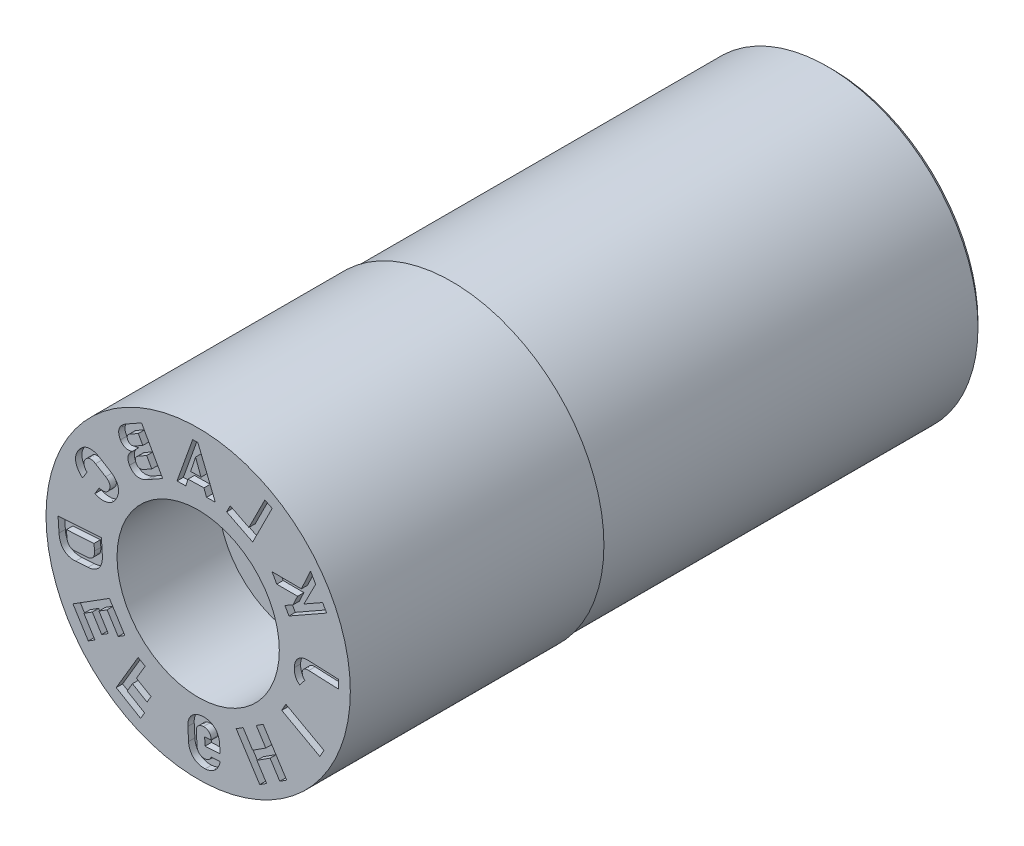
SolidWorks part; units mm, degrees
ref_plane "Front Plane" through (0, 0, 0) normal (0, 0, 1) x (1, 0, 0)
ref_plane "Top Plane" through (0, 0, 0) normal (0, 1, 0) x (1, 0, 0)
ref_plane "Right Plane" through (0, 0, 0) normal (1, 0, 0) x (0, 0, -1)
sketch "Sketch1" plane through (0, 0, 0) normal (1, 0, 0) x (0, 0, -1)
  line L2 (0, 6) -> (0, 3.2)
  line L3 (24.75, 6) -> (0, 6)
  line L4 (-3.7979, 0) -> (49996.2021, 0) construction
  line L8 (19, 1.5) -> (4, 1.5)
  line L9 (4, 3.2) -> (4, 1.5)
  line L10 (4, 3.2) -> (0, 3.2)
  line L12 (25, 3) -> (25, 5.75)
  line L16 (25, 5.75) -> (24.75, 6)
  line L17 (25, 3) -> (19, 3)
  line L18 (19, 1.5) -> (19, 3)
  dimension "D1" = 25
  dimension "D2" = 45
  dimension "D3" = 0.25
  dimension "D4" = 12
  dimension "D5" = 6.4
  dimension "D6" = 4
  dimension "D7" = 3
  dimension "D8" = 6
  dimension "D9" = 6
revolve "Revolve1" add sketch "Sketch1" angle 360 about L4
sketch "Sketch4" plane through (0, 0, 0) normal (1, 0, 0) x (0, 0, -1)
  line L0 (0, 0) -> (50000, 0) construction
  line L1 (25, -5.75) -> (25, 5.75) construction
  line L2 (10, 6.935) -> (25, 6.935)
  line L3 (10, 6.935) -> (10, 5.935)
  line L4 (10, 5.935) -> (25, 5.935)
  line L5 (25, 6.935) -> (25, 5.935)
  line L6 (24.75, 6) -> (0, 6) construction
  line L9 (0, 6.6) -> (0, -6.6) construction
  dimension "D1" = 1
  dimension "D2" = 0.065
  dimension "D3" = 10
revolve "Cut-Revolve1" cut sketch "Sketch4" angle 360 about L0
sketch "Sketch2" plane through (0, 0, 0) normal (0, 0, 1) x (1, 0, 0)
  line L0 (0, 0) -> (0, 6) construction
  line L1 (0, 0) -> (3, 5.1962) construction
  line L2 (0, 0) -> (5.1962, 3) construction
  line L3 (0, 0) -> (6, 0) construction
  line L4 (0, 0) -> (5.1962, -3) construction
  line L5 (0, 0) -> (3, -5.1962) construction
  line L6 (0, 0) -> (0, -6) construction
  line L7 (0, 0) -> (-3, -5.1962) construction
  line L8 (0, 0) -> (-5.1962, -3) construction
  line L9 (0, 0) -> (-6, 0) construction
  line L10 (0, 0) -> (-5.1962, 3) construction
  line L11 (0, 0) -> (-3, 5.1962) construction
  line L12 (4.1712, 2.0725) -> (4.6327, 2.9745)
  line L13 (4.6327, 2.9745) -> (4.4324, 3.3271)
  line L14 (4.4324, 3.3271) -> (4.069, 2.5376)
  line L16 (5.0662, 2.2101) -> (4.9073, 2.49)
  line L17 (4.9073, 2.49) -> (4.1712, 2.0725)
  line L18 (3.4215, 1.6471) -> (3.5804, 1.3672)
  line L19 (3.5804, 1.3672) -> (5.0662, 2.2101)
  line L20 (3.9184, 2.2106) -> (3.743, 1.8295)
  line L21 (4.069, 2.5376) -> (2.9114, 2.5466)
  line L22 (2.9114, 2.5466) -> (3.0998, 2.2142)
  line L23 (3.0998, 2.2142) -> (3.9184, 2.2106)
  line L24 (2.919, 4.7111) -> (2.6298, 4.8562)
  line L25 (2.6298, 4.8562) -> (2.0003, 3.6009)
  line L26 (-2.3603, 4.6286) -> (-2.1818, 4.3099)
  line L27 (2.1498, 3.1773) -> (2.919, 4.7111)
  line L28 (2.0003, 3.6009) -> (1.2621, 3.9712)
  line L29 (1.2621, 3.9712) -> (1.1225, 3.6927)
  line L30 (1.1225, 3.6927) -> (2.1498, 3.1773)
  line L31 (-2.0309, 4.0405) -> (-1.8308, 3.6834)
  line L32 (-0.0126, 5.4955) -> (-0.217, 5.4912)
  line L33 (-0.217, 5.4912) -> (-0.8349, 3.7694)
  line L34 (-0.8349, 3.7694) -> (-0.4881, 3.7766)
  line L35 (-0.4881, 3.7766) -> (-0.398, 4.0524)
  line L36 (-0.1038, 4.9519) -> (0.1127, 4.3734)
  line L37 (0.3296, 3.7936) -> (0.676, 3.8009)
  line L38 (0.676, 3.8009) -> (-0.0126, 5.4955)
  line L39 (0.1127, 4.3734) -> (-0.2958, 4.3649)
  line L41 (-0.398, 4.0524) -> (0.2279, 4.0655)
  line L42 (0.2279, 4.0655) -> (0.3296, 3.7936)
  line L43 (-1.8308, 3.6834) -> (-2.147, 3.5063)
  line L44 (-2.4469, 3.5702) -> (-2.4488, 3.5733)
  line L45 (-2.3471, 3.8634) -> (-2.0309, 4.0405)
  line L46 (-3.9121, -2.2103) -> (-3.5892, -2.0073)
  line L47 (-2.1818, 4.3099) -> (-2.4982, 4.1328)
  line L48 (-2.6764, 4.4515) -> (-2.3603, 4.6286)
  line L49 (-2.4335, -3.7648) -> (-2.0896, -3.1835)
  line L50 (-2.2315, 5.0549) -> (-2.8368, 4.7157)
  line L51 (-2.7072, 3.3737) -> (-2.7056, 3.3708)
  line L52 (-2.0229, 3.2219) -> (-1.8999, 3.2907)
  line L54 (2.8353, -3.8614) -> (3.219, -4.4581)
  line L56 (-1.8999, 3.2907) -> (-1.4002, 3.5707)
  line L57 (-1.4002, 3.5707) -> (-2.2315, 5.0549)
  line L58 (-3.4712, 2.793) -> (-3.8723, 3.0385)
  line L59 (-4.5581, 2.0107) -> (-4.3832, 2.2967)
  line L60 (-4.0471, 2.753) -> (-3.646, 2.5075)
  line L61 (-3.9005, 2.0011) -> (-4.0754, 1.7151)
  line L62 (-4.105, 0.0024) -> (-4.0884, -0.248)
  line L63 (-4.3591, -0.5997) -> (-4.8622, -0.6329)
  line L64 (-5.1764, -0.3196) -> (-5.1929, -0.0694)
  line L65 (2.1486, -3.9326) -> (1.7728, -3.3479)
  line L66 (3.743, 1.8295) -> (3.4215, 1.6471)
  line L67 (-4.8306, -0.9659) -> (-4.3463, -0.9338)
  line L68 (-3.779, -0.2192) -> (-3.8161, 0.3448)
  line L70 (-5.5244, 0.2322) -> (-5.4872, -0.3329)
  line L71 (-5.1929, -0.0694) -> (-4.105, 0.0024)
  line L73 (-3.8161, 0.3448) -> (-5.5244, 0.2322)
  line L75 (-4.5063, -2.5838) -> (-4.1735, -2.3746)
  line L77 (-3.4981, -1.5714) -> (-4.9382, -2.4766)
  line L78 (-3.5892, -2.0073) -> (-3.1535, -2.7008)
  line L79 (-3.1535, -2.7008) -> (-2.8918, -2.5365)
  line L80 (-2.8918, -2.5365) -> (-3.4981, -1.5714)
  line L82 (-4.1735, -2.3746) -> (-3.8061, -2.9589)
  line L83 (-3.8061, -2.9589) -> (-3.5448, -2.7944)
  line L84 (-3.5448, -2.7944) -> (-3.9121, -2.2103)
  line L86 (-4.9382, -2.4766) -> (-4.3319, -3.4417)
  line L87 (-4.3319, -3.4417) -> (-4.0706, -3.2772)
  line L88 (-4.0706, -3.2772) -> (-4.5063, -2.5838)
  line L91 (-2.7986, -4.382) -> (-2.5907, -4.0305)
  line L92 (-2.0896, -3.1835) -> (-2.3656, -3.0202)
  line L93 (-2.3656, -3.0202) -> (-3.2317, -4.4844)
  line L94 (-2.5907, -4.0305) -> (-2.016, -4.3705)
  line L95 (-2.016, -4.3705) -> (-1.8587, -4.1049)
  line L96 (-1.8587, -4.1049) -> (-2.4335, -3.7648)
  line L98 (-3.2317, -4.4844) -> (-2.27, -5.0535)
  line L99 (-2.27, -5.0535) -> (-2.1127, -4.7878)
  line L100 (-2.1127, -4.7878) -> (-2.7986, -4.382)
  line L102 (0.8636, -4.6997) -> (0.8458, -4.366)
  line L103 (-0.4057, -4.3953) -> (-0.3789, -4.8992)
  line L104 (0.8635, -4.9638) -> (0.5159, -4.9823)
  line L105 (-0.0456, -4.8814) -> (-0.0723, -4.3775)
  line L106 (0.5116, -4.3793) -> (0.5133, -4.4075)
  line L107 (0.5133, -4.4075) -> (0.2552, -4.4215)
  line L108 (0.2552, -4.4215) -> (0.2718, -4.7315)
  line L109 (0.2718, -4.7315) -> (0.8636, -4.6997)
  line L110 (3.219, -4.4581) -> (3.4908, -4.2835)
  line L111 (3.4908, -4.2835) -> (2.5629, -2.8401)
  line L112 (2.5629, -2.8401) -> (2.2911, -3.0147)
  line L113 (2.2911, -3.0147) -> (2.6669, -3.5993)
  line L114 (2.4284, -4.9662) -> (2.7007, -4.7913)
  line L115 (2.7007, -4.7913) -> (2.3171, -4.1947)
  line L116 (1.7728, -3.3479) -> (1.5005, -3.5228)
  line L117 (1.5005, -3.5228) -> (2.4284, -4.9662)
  line L118 (2.3171, -4.1947) -> (2.8353, -3.8614)
  line L120 (2.6669, -3.5993) -> (2.1486, -3.9326)
  line L122 (3.4567, -1.7056) -> (3.2958, -1.9988)
  line L123 (3.2958, -1.9988) -> (4.798, -2.8227)
  line L124 (4.798, -2.8227) -> (4.9589, -2.5294)
  line L125 (4.9589, -2.5294) -> (3.4567, -1.7056)
  line L126 (4.0038, -0.7722) -> (4.2063, -0.5172)
  line L127 (4.3611, -0.1037) -> (5.5253, -0.1536)
  line L128 (5.5253, -0.1536) -> (5.5396, 0.1799)
  line L129 (5.5396, 0.1799) -> (4.374, 0.23)
  line L130 (-0.2958, 4.3649) -> (-0.1038, 4.9519)
  circle A0 centre (0, 0) radius 3.8653 construction
  circle A1 centre (0, 0) radius 6 construction
  spline S0 degree 3 poles (-2.147, 3.5063) (-2.1759, 3.491) (-2.2197, 3.4709) (-2.2805, 3.4642) (-2.3215, 3.4679) (-2.3595, 3.4809) (-2.4068, 3.5105) (-2.4327, 3.5454) (-2.4469, 3.5702) knots 0 0 0 0 0.283986 0.407341 0.523418 0.636508 0.75074 1 1 1 1
  spline S1 degree 3 poles (-2.4488, 3.5733) (-2.4587, 3.5907) (-2.4706, 3.6178) (-2.4784, 3.6553) (-2.4796, 3.6822) (-2.4771, 3.7085) (-2.4701, 3.7339) (-2.4594, 3.7587) (-2.4442, 3.7823) (-2.4253, 3.8047) (-2.3947, 3.8344) (-2.3666, 3.852) (-2.3471, 3.8634) knots 0 0 0 0 0.172486 0.251676 0.328325 0.402454 0.477689 0.553909 0.633799 0.717923 0.805334 1 1 1 1
  spline S2 degree 3 poles (-2.4982, 4.1328) (-2.5243, 4.1192) (-2.564, 4.1006) (-2.6194, 4.0961) (-2.6571, 4.1004) (-2.692, 4.1135) (-2.7363, 4.1416) (-2.7599, 4.1753) (-2.7738, 4.1986) knots 0 0 0 0 0.277832 0.398607 0.514672 0.628815 0.743813 1 1 1 1
  spline S3 degree 3 poles (-2.7738, 4.1986) (-2.7858, 4.2202) (-2.7992, 4.2551) (-2.7984, 4.3034) (-2.7895, 4.3375) (-2.7725, 4.37) (-2.7376, 4.4123) (-2.7025, 4.4373) (-2.6764, 4.4515) knots 0 0 0 0 0.243006 0.354161 0.466966 0.585008 0.709189 1 1 1 1
  spline S4 degree 3 poles (-2.8368, 4.7157) (-2.8815, 4.6908) (-2.9439, 4.6494) (-3.014, 4.583) (-3.0564, 4.5322) (-3.0902, 4.4788) (-3.1148, 4.423) (-3.1295, 4.365) (-3.1356, 4.3056) (-3.1319, 4.2446) (-3.1148, 4.1598) (-3.0876, 4.0988) (-3.0656, 4.0594) knots 0 0 0 0 0.194786 0.282854 0.366198 0.445692 0.522431 0.59692 0.672178 0.748789 0.828229 1 1 1 1
  spline S5 degree 3 poles (-3.0656, 4.0594) (-3.0499, 4.0322) (-3.024, 3.9933) (-2.9806, 3.9507) (-2.9461, 3.9242) (-2.909, 3.9028) (-2.8696, 3.8863) (-2.8277, 3.8758) (-2.7839, 3.8698) (-2.7384, 3.8695) (-2.6743, 3.876) (-2.6265, 3.8894) (-2.5949, 3.9007) knots 0 0 0 0 0.172797 0.253868 0.332914 0.410582 0.4882 0.566647 0.646914 0.729831 0.815675 1 1 1 1
  spline S6 degree 3 poles (-2.5949, 3.9007) (-2.6232, 3.8789) (-2.6631, 3.8442) (-2.7049, 3.7896) (-2.7299, 3.7478) (-2.7493, 3.7043) (-2.7616, 3.6591) (-2.7688, 3.6131) (-2.7685, 3.5659) (-2.7628, 3.518) (-2.7461, 3.452) (-2.7246, 3.4045) (-2.7072, 3.3737) knots 0 0 0 0 0.180058 0.263783 0.344958 0.424782 0.502383 0.580016 0.658446 0.73902 0.822029 1 1 1 1
  spline S7 degree 3 poles (-2.7056, 3.3708) (-2.6835, 3.3308) (-2.645, 3.2756) (-2.5812, 3.2157) (-2.5305, 3.181) (-2.4764, 3.1544) (-2.4187, 3.1374) (-2.3581, 3.1289) (-2.2946, 3.1298) (-2.2288, 3.1394) (-2.1356, 3.1653) (-2.0675, 3.1966) (-2.0229, 3.2219) knots 0 0 0 0 0.172849 0.252224 0.329274 0.404442 0.479146 0.555557 0.635162 0.718344 0.806128 1 1 1 1
  spline S8 degree 3 poles (-3.2499, 1.9297) (-3.2335, 1.9567) (-3.2107, 1.9974) (-3.1863, 2.0534) (-3.1708, 2.0942) (-3.1584, 2.1348) (-3.1485, 2.1751) (-3.142, 2.2151) (-3.1382, 2.2548) (-3.1377, 2.294) (-3.1394, 2.3325) (-3.1447, 2.3704) (-3.1529, 2.4077) (-3.1637, 2.4444) (-3.1775, 2.4804) (-3.194, 2.5159) (-3.2139, 2.5504) (-3.2362, 2.5843) (-3.2617, 2.617) (-3.2898, 2.6489) (-3.3205, 2.6798) (-3.354, 2.7098) (-3.4035, 2.7489) (-3.4431, 2.7763) (-3.4712, 2.793) knots 0 0 0 0 0.093395 0.137867 0.180685 0.222706 0.263356 0.30334 0.342595 0.381331 0.419141 0.456735 0.494484 0.53194 0.569988 0.608498 0.647681 0.687739 0.728571 0.77031 0.813445 0.857468 0.903297 1 1 1 1
  spline S9 degree 3 poles (-3.8723, 3.0385) (-3.9001, 3.0556) (-3.9421, 3.079) (-3.9995, 3.1051) (-4.0414, 3.1214) (-4.0831, 3.1345) (-4.1241, 3.1457) (-4.1649, 3.1528) (-4.2051, 3.1575) (-4.2449, 3.1591) (-4.2841, 3.1579) (-4.3225, 3.154) (-4.3601, 3.1468) (-4.397, 3.1371) (-4.4331, 3.1244) (-4.4687, 3.1091) (-4.5032, 3.0905) (-4.537, 3.0693) (-4.5698, 3.0455) (-4.6015, 3.0186) (-4.6319, 2.9888) (-4.6613, 2.9565) (-4.6997, 2.909) (-4.7258, 2.8705) (-4.7423, 2.8435) knots 0 0 0 0 0.096419 0.14217 0.186461 0.229443 0.271255 0.312127 0.351941 0.391171 0.429722 0.467793 0.505489 0.542813 0.580646 0.618521 0.657329 0.6966 0.736521 0.777346 0.819285 0.862414 0.90656 1 1 1 1
  spline S10 degree 3 poles (-4.7423, 2.8435) (-4.7687, 2.7996) (-4.8024, 2.7309) (-4.8267, 2.6337) (-4.8351, 2.5615) (-4.834, 2.4889) (-4.8231, 2.4166) (-4.8021, 2.3452) (-4.7717, 2.2746) (-4.7321, 2.2051) (-4.665, 2.1126) (-4.6031, 2.0501) (-4.5581, 2.0107) knots 0 0 0 0 0.164359 0.242523 0.319819 0.396758 0.474197 0.553045 0.634665 0.719808 0.808406 1 1 1 1
  spline S11 degree 3 poles (-4.3832, 2.2967) (-4.4025, 2.316) (-4.4305, 2.3454) (-4.4596, 2.3891) (-4.4772, 2.4214) (-4.4901, 2.4541) (-4.5001, 2.4865) (-4.5046, 2.5192) (-4.5058, 2.5515) (-4.503, 2.5836) (-4.4921, 2.6259) (-4.4786, 2.6561) (-4.4667, 2.675) knots 0 0 0 0 0.195176 0.28654 0.37324 0.456219 0.536212 0.614028 0.690102 0.765908 0.841951 1 1 1 1
  spline S12 degree 3 poles (-4.4667, 2.675) (-4.4522, 2.6992) (-4.427, 2.7322) (-4.3866, 2.7677) (-4.3552, 2.7883) (-4.3215, 2.8031) (-4.2861, 2.8124) (-4.249, 2.8162) (-4.2103, 2.8148) (-4.1706, 2.8071) (-4.1141, 2.7905) (-4.0739, 2.7687) (-4.0471, 2.753) knots 0 0 0 0 0.174816 0.254583 0.331752 0.4066 0.480982 0.557388 0.636835 0.719716 0.807055 1 1 1 1
  spline S13 degree 3 poles (-3.646, 2.5075) (-3.6195, 2.4913) (-3.5827, 2.4645) (-3.5416, 2.4226) (-3.5171, 2.3906) (-3.4982, 2.357) (-3.4851, 2.3222) (-3.4775, 2.2864) (-3.4754, 2.2497) (-3.4792, 2.2122) (-3.4925, 2.16) (-3.511, 2.1227) (-3.5256, 2.0986) knots 0 0 0 0 0.192502 0.280292 0.362664 0.441768 0.517825 0.592476 0.667438 0.744799 0.824735 1 1 1 1
  spline S14 degree 3 poles (-3.5256, 2.0986) (-3.5375, 2.0795) (-3.5578, 2.0526) (-3.5913, 2.0238) (-3.6183, 2.0061) (-3.6477, 1.9921) (-3.6787, 1.981) (-3.712, 1.9752) (-3.7469, 1.9723) (-3.7834, 1.9732) (-3.8356, 1.9804) (-3.8744, 1.9918) (-3.9005, 2.0011) knots 0 0 0 0 0.160081 0.236116 0.312169 0.388724 0.466101 0.54522 0.627432 0.713977 0.803689 1 1 1 1
  spline S15 degree 3 poles (-4.0754, 1.7151) (-4.0195, 1.6936) (-3.9356, 1.667) (-3.8226, 1.6494) (-3.7428, 1.6459) (-3.6661, 1.6505) (-3.5931, 1.6645) (-3.524, 1.6875) (-3.4591, 1.7192) (-3.3982, 1.7591) (-3.3233, 1.8255) (-3.2765, 1.8859) (-3.2499, 1.9297) knots 0 0 0 0 0.192102 0.280672 0.365808 0.447541 0.526353 0.603189 0.680187 0.757178 0.835634 1 1 1 1
  spline S16 degree 3 poles (-4.0884, -0.248) (-4.0871, -0.273) (-4.0862, -0.3097) (-4.0917, -0.357) (-4.0978, -0.3894) (-4.1063, -0.4199) (-4.1177, -0.4483) (-4.1319, -0.4745) (-4.1484, -0.4987) (-4.1673, -0.5204) (-4.188, -0.54) (-4.2113, -0.5564) (-4.2367, -0.5704) (-4.2643, -0.5818) (-4.3049, -0.5937) (-4.3371, -0.5986) (-4.3591, -0.5997) knots 0 0 0 0 0.14907 0.217385 0.282879 0.345337 0.405621 0.464448 0.522126 0.579343 0.63528 0.691485 0.748535 0.807147 0.868664 1 1 1 1
  spline S17 degree 3 poles (-4.8622, -0.6329) (-4.8842, -0.6344) (-4.9168, -0.6345) (-4.9585, -0.6272) (-4.9876, -0.6202) (-5.0143, -0.609) (-5.0396, -0.5959) (-5.063, -0.5795) (-5.0844, -0.5602) (-5.104, -0.5385) (-5.1208, -0.514) (-5.1361, -0.4876) (-5.1486, -0.4585) (-5.1592, -0.4273) (-5.1698, -0.3809) (-5.1751, -0.3447) (-5.1764, -0.3196) knots 0 0 0 0 0.131403 0.192788 0.251651 0.30887 0.364824 0.421034 0.478337 0.535992 0.59437 0.654772 0.717284 0.782701 0.85073 1 1 1 1
  spline S18 degree 3 poles (-5.4872, -0.3329) (-5.485, -0.3673) (-5.4796, -0.4179) (-5.4677, -0.4835) (-5.4565, -0.5296) (-5.4438, -0.5737) (-5.4287, -0.6156) (-5.4116, -0.6555) (-5.392, -0.693) (-5.371, -0.7286) (-5.3473, -0.7614) (-5.3225, -0.7923) (-5.2948, -0.8203) (-5.2659, -0.8464) (-5.2349, -0.8697) (-5.2021, -0.8908) (-5.1672, -0.9093) (-5.1307, -0.9255) (-5.0926, -0.9392) (-5.0527, -0.9498) (-5.0114, -0.9586) (-4.9684, -0.9644) (-4.9079, -0.9687) (-4.8617, -0.9676) (-4.8306, -0.9659) knots 0 0 0 0 0.09974 0.147124 0.192678 0.236825 0.279748 0.32161 0.362273 0.402114 0.440851 0.479134 0.516793 0.5544 0.591662 0.629051 0.667054 0.705622 0.744502 0.784211 0.824761 0.866534 0.909716 1 1 1 1
  spline S19 degree 3 poles (-4.3463, -0.9338) (-4.3166, -0.9317) (-4.2726, -0.9267) (-4.2158, -0.9146) (-4.1751, -0.9044) (-4.1366, -0.8904) (-4.0992, -0.8751) (-4.0636, -0.8573) (-4.0296, -0.8373) (-3.9973, -0.8152) (-3.9672, -0.7904) (-3.9393, -0.7634) (-3.9127, -0.7347) (-3.8896, -0.7027) (-3.8674, -0.6694) (-3.848, -0.6334) (-3.8301, -0.5954) (-3.8149, -0.555) (-3.8018, -0.5129) (-3.7915, -0.4688) (-3.784, -0.4227) (-3.7789, -0.3745) (-3.775, -0.3064) (-3.7765, -0.2543) (-3.779, -0.2192) knots 0 0 0 0 0.08643 0.127888 0.168208 0.207699 0.246676 0.285052 0.323013 0.360748 0.398341 0.435858 0.473305 0.51134 0.549953 0.589151 0.629809 0.671474 0.71404 0.757555 0.802537 0.849254 0.897844 1 1 1 1
  spline S20 degree 3 poles (0.8458, -4.366) (0.8437, -4.3352) (0.8397, -4.2896) (0.8281, -4.2305) (0.8174, -4.1884) (0.8044, -4.1477) (0.789, -4.1085) (0.7713, -4.071) (0.7513, -4.0351) (0.7293, -4.0009) (0.7049, -3.969) (0.6794, -3.9387) (0.6514, -3.9111) (0.6216, -3.8855) (0.5898, -3.8625) (0.5565, -3.8409) (0.5211, -3.8222) (0.4842, -3.8055) (0.4459, -3.7912) (0.4062, -3.7799) (0.3655, -3.7704) (0.3233, -3.764) (0.2648, -3.7591) (0.2201, -3.7584) (0.19, -3.7604) knots 0 0 0 0 0.092115 0.136278 0.179365 0.221873 0.263626 0.304798 0.345575 0.386144 0.425925 0.465206 0.504302 0.543232 0.582217 0.621417 0.66136 0.701682 0.742094 0.783109 0.82471 0.866861 0.910182 1 1 1 1
  spline S21 degree 3 poles (0.19, -3.7604) (0.1598, -3.7625) (0.115, -3.7663) (0.057, -3.778) (0.0156, -3.7881) (-0.0243, -3.8008) (-0.0627, -3.8157) (-0.0997, -3.833) (-0.135, -3.8525) (-0.1687, -3.874) (-0.2003, -3.8973) (-0.2299, -3.9223) (-0.2572, -3.9492) (-0.2822, -3.9782) (-0.3051, -4.009) (-0.3265, -4.0411) (-0.3448, -4.0755) (-0.3616, -4.111) (-0.3752, -4.1482) (-0.3872, -4.1863) (-0.3956, -4.2259) (-0.4025, -4.2664) (-0.407, -4.323) (-0.4074, -4.3662) (-0.4057, -4.3953) knots 0 0 0 0 0.092699 0.137286 0.180721 0.223201 0.265242 0.306681 0.348035 0.388686 0.428815 0.468113 0.506985 0.546165 0.58512 0.624268 0.664152 0.7041 0.744433 0.785184 0.826279 0.868134 0.910753 1 1 1 1
  spline S22 degree 3 poles (-0.3789, -4.8992) (-0.3768, -4.93) (-0.3728, -4.9756) (-0.3613, -5.0346) (-0.3505, -5.0768) (-0.3375, -5.1175) (-0.3221, -5.1567) (-0.3044, -5.1942) (-0.2846, -5.2301) (-0.2623, -5.2638) (-0.2386, -5.2961) (-0.2126, -5.326) (-0.1845, -5.3535) (-0.1547, -5.3788) (-0.1234, -5.4027) (-0.0897, -5.4238) (-0.0543, -5.4427) (-0.0174, -5.4594) (0.0209, -5.4735) (0.0604, -5.4851) (0.1013, -5.4936) (0.1432, -5.5005) (0.2018, -5.5055) (0.2464, -5.5054) (0.2764, -5.5037) knots 0 0 0 0 0.09219 0.136389 0.179511 0.222053 0.26384 0.305046 0.345856 0.38615 0.425784 0.465296 0.504158 0.543119 0.582112 0.621617 0.661593 0.701947 0.742391 0.78344 0.824531 0.867138 0.910153 1 1 1 1
  spline S23 degree 3 poles (0.2764, -5.5037) (0.3258, -5.5013) (0.3986, -5.4893) (0.491, -5.4584) (0.5554, -5.4271) (0.6154, -5.3891) (0.6704, -5.3448) (0.7192, -5.2937) (0.7623, -5.237) (0.799, -5.175) (0.8385, -5.0852) (0.8564, -5.013) (0.8635, -4.9638) knots 0 0 0 0 0.17073 0.253555 0.336069 0.417894 0.498687 0.579505 0.661559 0.744543 0.827905 1 1 1 1
  spline S24 degree 3 poles (0.5159, -4.9823) (0.5108, -5) (0.5012, -5.0264) (0.4808, -5.0574) (0.4635, -5.0792) (0.4432, -5.0985) (0.4209, -5.1158) (0.3969, -5.1311) (0.3712, -5.1442) (0.344, -5.1543) (0.3068, -5.1653) (0.2779, -5.1688) (0.2586, -5.17) knots 0 0 0 0 0.163545 0.244363 0.326081 0.408336 0.490616 0.574314 0.658826 0.744665 0.82891 1 1 1 1
  spline S25 degree 3 poles (0.2586, -5.17) (0.2315, -5.1715) (0.1914, -5.1694) (0.1406, -5.1562) (0.1056, -5.1417) (0.0736, -5.1224) (0.0449, -5.0988) (0.0199, -5.0709) (-0.0018, -5.0394) (-0.0194, -5.0041) (-0.0381, -4.952) (-0.0438, -4.9099) (-0.0456, -4.8814) knots 0 0 0 0 0.172158 0.253143 0.33268 0.411758 0.489998 0.568044 0.648935 0.732772 0.817932 1 1 1 1
  spline S26 degree 3 poles (-0.0723, -4.3775) (-0.0741, -4.3522) (-0.0714, -4.3146) (-0.0584, -4.2671) (-0.044, -4.2345) (-0.0255, -4.2045) (-0.0028, -4.1776) (0.024, -4.1541) (0.0548, -4.1344) (0.0889, -4.1182) (0.1395, -4.1011) (0.1802, -4.0961) (0.2078, -4.0941) knots 0 0 0 0 0.169496 0.249303 0.328489 0.406527 0.484423 0.562784 0.643966 0.728133 0.814124 1 1 1 1
  spline S27 degree 3 poles (0.2078, -4.0941) (0.2352, -4.0928) (0.2757, -4.0944) (0.3271, -4.1071) (0.3621, -4.1213) (0.3942, -4.1394) (0.4228, -4.1623) (0.4478, -4.1893) (0.4692, -4.2204) (0.486, -4.2554) (0.5045, -4.3078) (0.5096, -4.3504) (0.5116, -4.3793) knots 0 0 0 0 0.174469 0.256028 0.336001 0.413903 0.490188 0.568212 0.647583 0.729648 0.81477 1 1 1 1
  spline S28 degree 3 poles (3.7898, -0.2909) (3.7878, -0.3408) (3.7917, -0.4146) (3.8132, -0.5089) (3.8374, -0.5736) (3.8685, -0.6333) (3.9195, -0.7043) (3.9678, -0.7484) (4.0038, -0.7722) knots 0 0 0 0 0.271973 0.400312 0.525574 0.647267 0.765611 1 1 1 1
  spline S29 degree 3 poles (4.2063, -0.5172) (4.1891, -0.503) (4.1663, -0.4786) (4.1417, -0.4418) (4.1268, -0.4124) (4.1151, -0.3819) (4.1048, -0.3401) (4.1021, -0.308) (4.1033, -0.2867) knots 0 0 0 0 0.255231 0.381316 0.506998 0.632723 0.755324 1 1 1 1
  spline S30 degree 3 poles (4.1033, -0.2867) (4.1045, -0.2589) (4.1128, -0.217) (4.144, -0.1717) (4.1743, -0.1443) (4.2121, -0.1238) (4.2745, -0.105) (4.3256, -0.1017) (4.3611, -0.1037) knots 0 0 0 0 0.235579 0.344935 0.456481 0.574963 0.702365 1 1 1 1
  spline S31 degree 3 poles (4.374, 0.23) (4.3189, 0.2328) (4.2382, 0.2287) (4.1361, 0.2062) (4.079, 0.1849) (4.0368, 0.1641) (4.0075, 0.1462) (3.9793, 0.1272) (3.9538, 0.1053) (3.9296, 0.0822) (3.907, 0.0572) (3.8866, 0.03) (3.8678, 0.0011) (3.8513, -0.0296) (3.8365, -0.0621) (3.8239, -0.0962) (3.813, -0.1318) (3.8042, -0.1692) (3.7949, -0.2223) (3.7911, -0.2632) (3.7898, -0.2909) knots 0 0 0 0 0.185997 0.270621 0.35164 0.390622 0.429278 0.467346 0.504968 0.542395 0.580108 0.618424 0.656924 0.69617 0.736012 0.777014 0.8186 0.861699 0.906468 1 1 1 1
  point P19 (0, 0)
  dimension "D1" = 12
extrude "Cut-Extrude1" cut sketch "Sketch2" against normal blind 0.25
sketch "Sketch3" plane through (0, 0, -4) normal (0, 0, 1) x (1, 0, 0)
  line L0 (0, 0) -> (0, 50000) construction
  line L1 (0.866, 1.5) -> (-0.866, 1.5)
  line L2 (-0.866, 1.5) -> (-1.7321, 0)
  line L3 (-1.7321, 0) -> (-0.866, -1.5)
  line L4 (-0.866, -1.5) -> (0.866, -1.5)
  line L5 (0.866, -1.5) -> (1.7321, 0)
  line L6 (1.7321, 0) -> (0.866, 1.5)
  line L7 (0, 0) -> (50000, 0) construction
  circle A0 centre (0, 0) radius 1.5 construction
  circle A1 centre (0, 0) radius 1.5 construction
extrude "Cut-Extrude2" cut sketch "Sketch3" against normal blind 3
